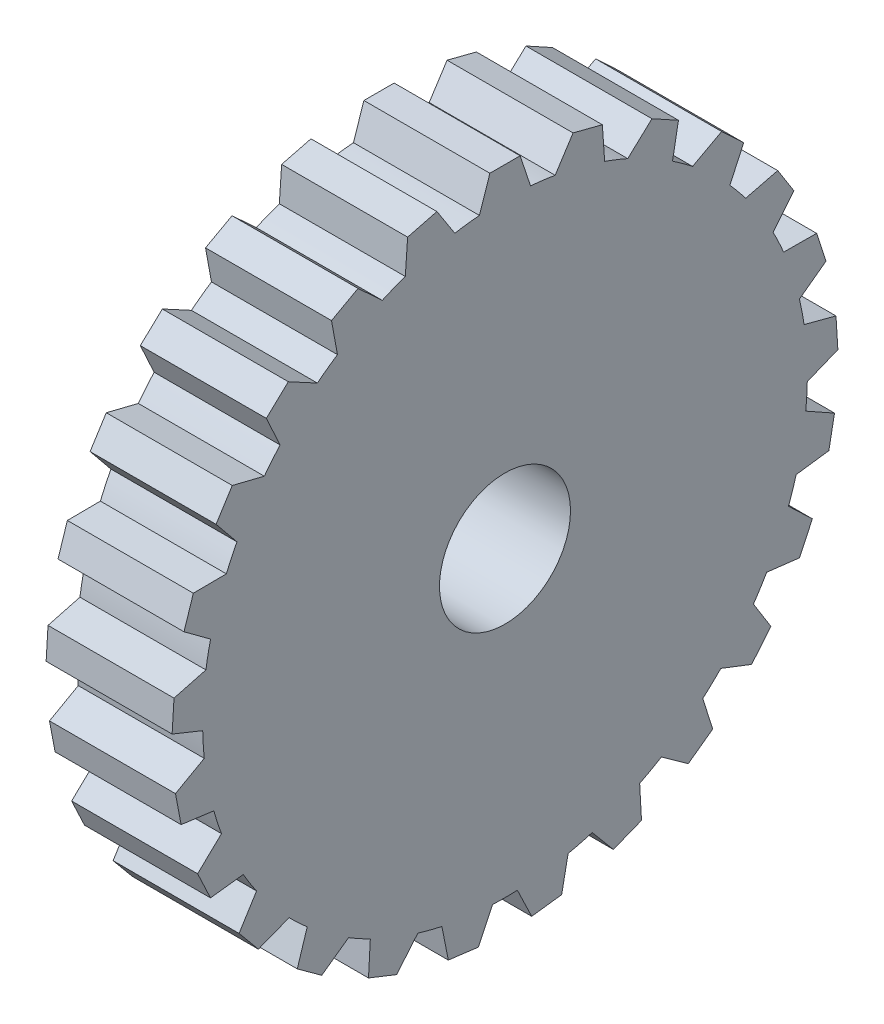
SolidWorks part; units mm, degrees
ref_plane "Front Plane" through (0, 0, 0) normal (0, 0, 1) x (1, 0, 0)
ref_plane "Top Plane" through (0, 0, 0) normal (0, 1, 0) x (1, 0, 0)
ref_plane "Right Plane" through (0, 0, 0) normal (1, 0, 0) x (0, 0, -1)
sketch "Sketch1" plane through (0, 0, 0) normal (1, 0, 0) x (0, 0, -1)
  circle A0 centre (0, 0) radius 7.62
extrude "Boss-Extrude1" add sketch "Sketch1" along normal blind 3.175
sketch "Sketch2" plane through (3.175, 0, 0) normal (1, 0, 0) x (0, 0, -1)
  line L0 (1.7155, 8.2134) -> (2.4535, 8.0239)
  line L1 (1.0622, 7.2011) -> (1.7155, 8.2134)
  line L2 (-0.381, 8.382) -> (0.381, 8.382)
  line L3 (-0.762, 7.239) -> (0.762, 7.239)
  line L4 (0.762, 7.239) -> (0.381, 8.382)
  line L5 (-0.762, 7.239) -> (-0.381, 8.382)
  line L6 (1.0622, 7.2011) -> (2.5383, 6.8221)
  line L7 (2.5383, 6.8221) -> (2.4535, 8.0239)
  line L8 (3.7042, 7.5288) -> (4.3719, 7.1617)
  line L9 (2.8197, 6.7107) -> (3.7042, 7.5288)
  line L10 (2.8197, 6.7107) -> (4.1552, 5.9765)
  line L11 (4.1552, 5.9765) -> (4.3719, 7.1617)
  line L12 (5.4601, 6.371) -> (6.0156, 5.8494)
  line L13 (4.4, 5.7986) -> (5.4601, 6.371)
  line L14 (4.4, 5.7986) -> (5.5109, 4.7554)
  line L15 (5.5109, 4.7554) -> (6.0156, 5.8494)
  line L16 (6.873, 4.813) -> (7.2813, 4.1696)
  line L17 (5.7038, 4.5222) -> (6.873, 4.813)
  line L18 (5.7038, 4.5222) -> (6.5204, 3.2355)
  line L19 (6.5204, 3.2355) -> (7.2813, 4.1696)
  line L20 (7.854, 2.9525) -> (8.0895, 2.2278)
  line L21 (6.6492, 2.9617) -> (7.854, 2.9525)
  line L22 (6.6492, 2.9617) -> (7.1202, 1.5123)
  line L23 (7.1202, 1.5123) -> (8.0895, 2.2278)
  line L24 (8.3415, 0.9066) -> (8.3894, 0.1461)
  line L25 (7.1769, 1.215) -> (8.3415, 0.9066)
  line L26 (7.1769, 1.215) -> (7.2726, -0.306)
  line L27 (7.2726, -0.306) -> (8.3894, 0.1461)
  line L28 (8.3049, -1.1964) -> (8.1621, -1.9449)
  line L29 (7.2536, -0.608) -> (8.3049, -1.1964)
  line L30 (7.2536, -0.608) -> (6.968, -2.105)
  line L31 (6.968, -2.105) -> (8.1621, -1.9449)
  line L32 (7.7465, -3.2241) -> (7.422, -3.9136)
  line L33 (6.8745, -2.3927) -> (7.7465, -3.2241)
  line L34 (6.8745, -2.3927) -> (6.2256, -3.7717)
  line L35 (6.2256, -3.7717) -> (7.422, -3.9136)
  line L36 (6.7013, -5.0493) -> (6.2156, -5.6365)
  line L37 (6.0635, -4.0272) -> (6.7013, -5.0493)
  line L38 (6.0635, -4.0272) -> (5.092, -5.2014)
  line L39 (5.092, -5.2014) -> (6.2156, -5.6365)
  line L40 (5.2351, -6.5572) -> (4.6186, -7.0051)
  line L41 (4.8714, -5.4086) -> (5.2351, -6.5572)
  line L42 (4.8714, -5.4086) -> (3.6385, -6.3044)
  line L43 (3.6385, -6.3044) -> (4.6186, -7.0051)
  line L44 (3.4399, -7.6531) -> (2.7314, -7.9336)
  line L45 (3.3733, -6.4501) -> (3.4399, -7.6531)
  line L46 (3.3733, -6.4501) -> (1.9564, -7.0112)
  line L47 (1.9564, -7.0112) -> (2.7314, -7.9336)
  line L48 (1.4285, -8.2682) -> (0.6725, -8.3637)
  line L49 (1.6633, -7.0864) -> (1.4285, -8.2682)
  line L50 (1.6633, -7.0864) -> (0.1513, -7.2774)
  line L51 (0.1513, -7.2774) -> (0.6725, -8.3637)
  line L52 (-0.6725, -8.3637) -> (-1.4285, -8.2682)
  line L53 (-0.1513, -7.2774) -> (-0.6725, -8.3637)
  line L54 (-0.1513, -7.2774) -> (-1.6633, -7.0864)
  line L55 (-1.6633, -7.0864) -> (-1.4285, -8.2682)
  line L56 (-2.7314, -7.9336) -> (-3.4399, -7.6531)
  line L57 (-1.9564, -7.0112) -> (-2.7314, -7.9336)
  line L58 (-1.9564, -7.0112) -> (-3.3733, -6.4501)
  line L59 (-3.3733, -6.4501) -> (-3.4399, -7.6531)
  line L60 (-4.6186, -7.0051) -> (-5.2351, -6.5572)
  line L61 (-3.6385, -6.3044) -> (-4.6186, -7.0051)
  line L62 (-3.6385, -6.3044) -> (-4.8714, -5.4086)
  line L63 (-4.8714, -5.4086) -> (-5.2351, -6.5572)
  line L64 (-6.2156, -5.6365) -> (-6.7013, -5.0493)
  line L65 (-5.092, -5.2014) -> (-6.2156, -5.6365)
  line L66 (-5.092, -5.2014) -> (-6.0635, -4.0272)
  line L67 (-6.0635, -4.0272) -> (-6.7013, -5.0493)
  line L68 (-7.422, -3.9136) -> (-7.7465, -3.2241)
  line L69 (-6.2256, -3.7717) -> (-7.422, -3.9136)
  line L70 (-6.2256, -3.7717) -> (-6.8745, -2.3927)
  line L71 (-6.8745, -2.3927) -> (-7.7465, -3.2241)
  line L72 (-8.1621, -1.9449) -> (-8.3049, -1.1964)
  line L73 (-6.968, -2.105) -> (-8.1621, -1.9449)
  line L74 (-6.968, -2.105) -> (-7.2536, -0.608)
  line L75 (-7.2536, -0.608) -> (-8.3049, -1.1964)
  line L76 (-8.3894, 0.1461) -> (-8.3415, 0.9066)
  line L77 (-7.2726, -0.306) -> (-8.3894, 0.1461)
  line L78 (-7.2726, -0.306) -> (-7.1769, 1.215)
  line L79 (-7.1769, 1.215) -> (-8.3415, 0.9066)
  line L80 (-8.0895, 2.2278) -> (-7.854, 2.9525)
  line L81 (-7.1202, 1.5123) -> (-8.0895, 2.2278)
  line L82 (-7.1202, 1.5123) -> (-6.6492, 2.9617)
  line L83 (-6.6492, 2.9617) -> (-7.854, 2.9525)
  line L84 (-7.2813, 4.1696) -> (-6.873, 4.813)
  line L85 (-6.5204, 3.2355) -> (-7.2813, 4.1696)
  line L86 (-6.5204, 3.2355) -> (-5.7038, 4.5222)
  line L87 (-5.7038, 4.5222) -> (-6.873, 4.813)
  line L88 (-6.0156, 5.8494) -> (-5.4601, 6.371)
  line L89 (-5.5109, 4.7554) -> (-6.0156, 5.8494)
  line L90 (-5.5109, 4.7554) -> (-4.4, 5.7986)
  line L91 (-4.4, 5.7986) -> (-5.4601, 6.371)
  line L92 (-4.3719, 7.1617) -> (-3.7042, 7.5288)
  line L93 (-4.1552, 5.9765) -> (-4.3719, 7.1617)
  line L94 (-4.1552, 5.9765) -> (-2.8197, 6.7107)
  line L95 (-2.8197, 6.7107) -> (-3.7042, 7.5288)
  line L96 (-2.4535, 8.0239) -> (-1.7155, 8.2134)
  line L97 (-2.5383, 6.8221) -> (-2.4535, 8.0239)
  line L98 (-2.5383, 6.8221) -> (-1.0622, 7.2011)
  line L99 (-1.0622, 7.2011) -> (-1.7155, 8.2134)
  dimension "D1" = 25
extrude "Boss-Extrude2" add sketch "Sketch2" against normal blind 3.175
sketch "Sketch3" plane through (3.175, 0, 0) normal (1, 0, 0) x (0, 0, -1)
  circle A0 centre (0, 0) radius 1.651
extrude "Cut-Extrude1" cut sketch "Sketch3" against normal blind 3.175
